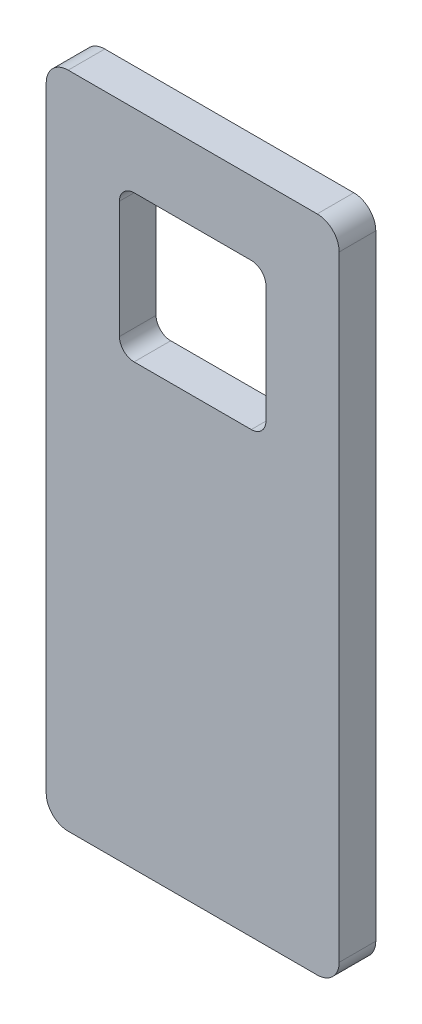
SolidWorks part; units mm, degrees
ref_plane "Front Plane" through (0, 0, 0) normal (0, 0, 1) x (1, 0, 0)
ref_plane "Top Plane" through (0, 0, 0) normal (0, 1, 0) x (1, 0, 0)
ref_plane "Right Plane" through (0, 0, 0) normal (1, 0, 0) x (0, 0, -1)
sketch "Sketch1" plane through (0, 0, 0) normal (0, 0, 1) x (1, 0, 0)
  line L1 (20, -45) -> (-20, -45)
  line L2 (20, -45) -> (20, 45)
  line L3 (20, 45) -> (-20, 45)
  line L4 (-20, -45) -> (-20, 45)
  line L5 (20, -45) -> (-20, 45) construction
  line L6 (20, 45) -> (-20, -45) construction
  point P0 (0, 0)
  dimension "D1" = 90
  dimension "D2" = 40
extrude "Boss-Extrude1" add sketch "Sketch1" along normal mid plane 5
fillet "Fillet1" radius 3 4 edges at (-20, -45, 0) (20, -45, 0) (20, 45, 0) (-20, 45, 0)
sketch "Sketch2" plane through (0, 0, 2.5) normal (0, 0, 1) x (1, 0, 0)
  line L0 (17, 45) -> (-17, 45) construction
  line L1 (10, 15) -> (-10, 15)
  line L2 (10, 15) -> (10, 35)
  line L3 (10, 35) -> (-10, 35)
  line L4 (-10, 15) -> (-10, 35)
  line L5 (10, 15) -> (-10, 35) construction
  line L6 (10, 35) -> (-10, 15) construction
  line L7 (-20, 42) -> (-20, -42) construction
  line L9 (0, 25) -> (0, 0) construction
  point P0 (0, 25)
  dimension "D1" = 10
  dimension "D2" = 10
  dimension "D3" = 20
extrude "Cut-Extrude1" cut sketch "Sketch2" against normal through all
fillet "Fillet2" radius 2 4 edges at (10, 15, 0) (10, 35, 0) (-10, 35, 0) (-10, 15, 0)
